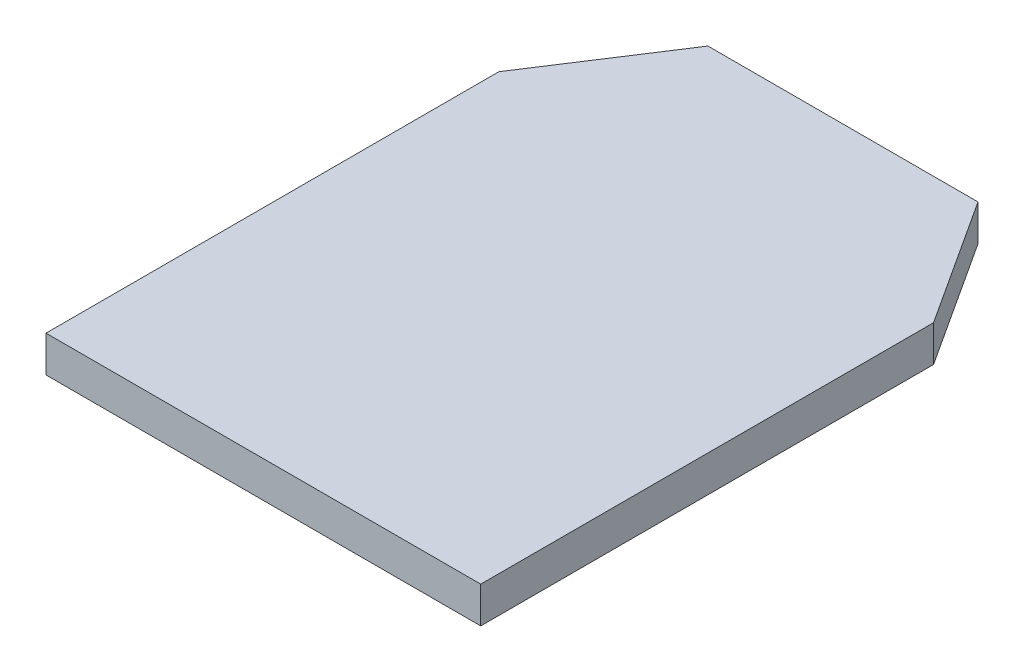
SolidWorks part; units mm, degrees
ref_plane "Plan de face" through (0, 0, 0) normal (0, 0, 1) x (1, 0, 0)
ref_plane "Plan de dessus" through (0, 0, 0) normal (0, 1, 0) x (1, 0, 0)
ref_plane "Plan de droite" through (0, 0, 0) normal (1, 0, 0) x (0, 0, -1)
sketch "Esquisse1" plane through (0, 0, 0) normal (0, 1, 0) x (1, 0, 0)
  line L0 (-37.2707, 45) -> (37.2707, 45)
  line L1 (37.2707, 45) -> (60, 10)
  line L2 (60, 10) -> (60, -115)
  line L3 (60, -115) -> (-60, -115)
  line L4 (0, 75.879) -> (0, -119.119) construction
  line L5 (-60, 10) -> (-60, -115)
  line L6 (-37.2707, 45) -> (-60, 10)
  point P8 (0, -115)
  point P10 (0, 45)
  dimension "D1" = 60
  dimension "D2" = 125
  dimension "D3" = 160
  dimension "D4" = 33
extrude "Extrusion1" add sketch "Esquisse1" along normal blind 10
